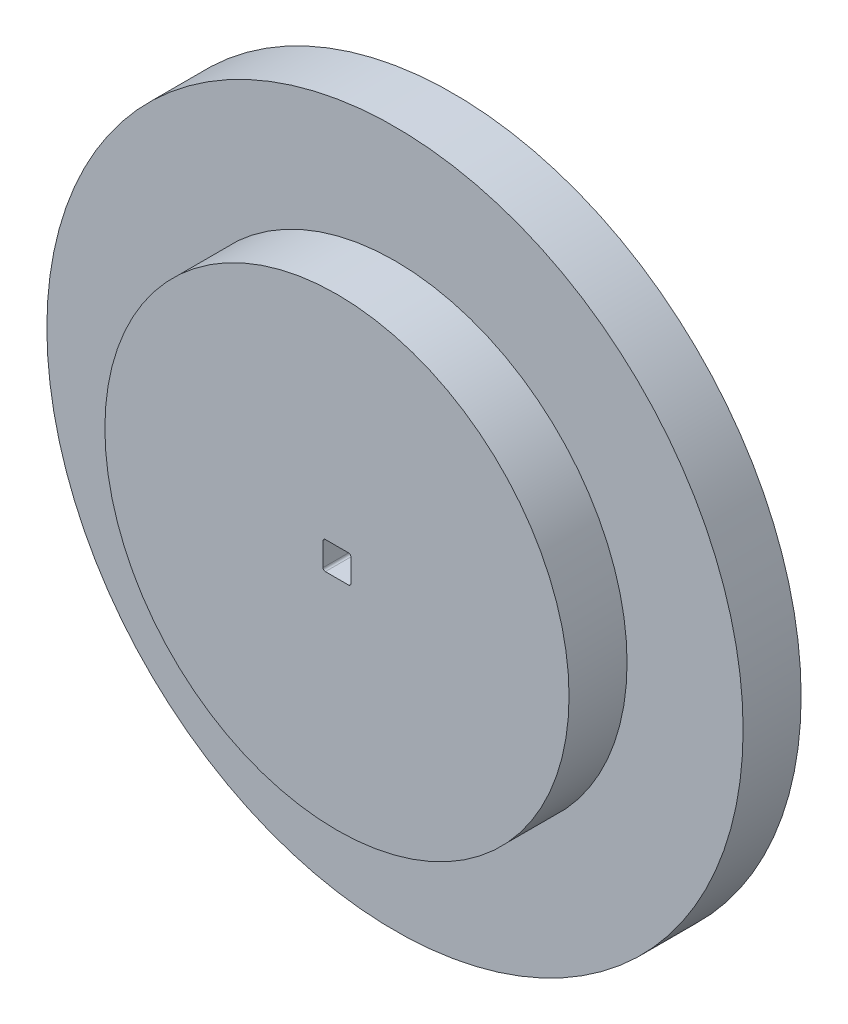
SolidWorks part; units mm, degrees
ref_plane "Front Plane" through (0, 0, 0) normal (0, 0, 1) x (1, 0, 0)
ref_plane "Top Plane" through (0, 0, 0) normal (0, 1, 0) x (1, 0, 0)
ref_plane "Right Plane" through (0, 0, 0) normal (1, 0, 0) x (0, 0, -1)
sketch "Sketch1" plane through (0, 0, 0) normal (0, 0, 1) x (1, 0, 0)
  circle A0 centre (0, 0) radius 38.1
  dimension "D1" = 76.2
extrude "Boss-Extrude1" add sketch "Sketch1" along normal blind 6.35
sketch "Sketch2" plane through (0, 0, 6.35) normal (0, 0, 1) x (1, 0, 0)
  circle A0 centre (0, 0) radius 25.4
extrude "Boss-Extrude2" add sketch "Sketch2" along normal blind 6.35
sketch "Sketch3" plane through (0, 0, 0) normal (0, 0, -1) x (-1, 0, 0)
  line L1 (-1.524, 1.524) -> (1.524, 1.524)
  line L2 (-1.524, 1.524) -> (-1.524, -1.524)
  line L3 (-1.524, -1.524) -> (1.524, -1.524)
  line L4 (1.524, 1.524) -> (1.524, -1.524)
  line L5 (-1.524, 1.524) -> (1.524, -1.524) construction
  line L6 (-1.524, -1.524) -> (1.524, 1.524) construction
  point P0 (0, 0)
  dimension "D1" = 3.048
  dimension "D2" = 3.048
extrude "Cut-Extrude1" cut sketch "Sketch3" against normal through all
fillet "Fillet1" radius 0.254 4 edges at (-1.524, 1.524, 6.35) (-1.524, -1.524, 6.35) (1.524, -1.524, 6.35) (1.524, 1.524, 6.35)
